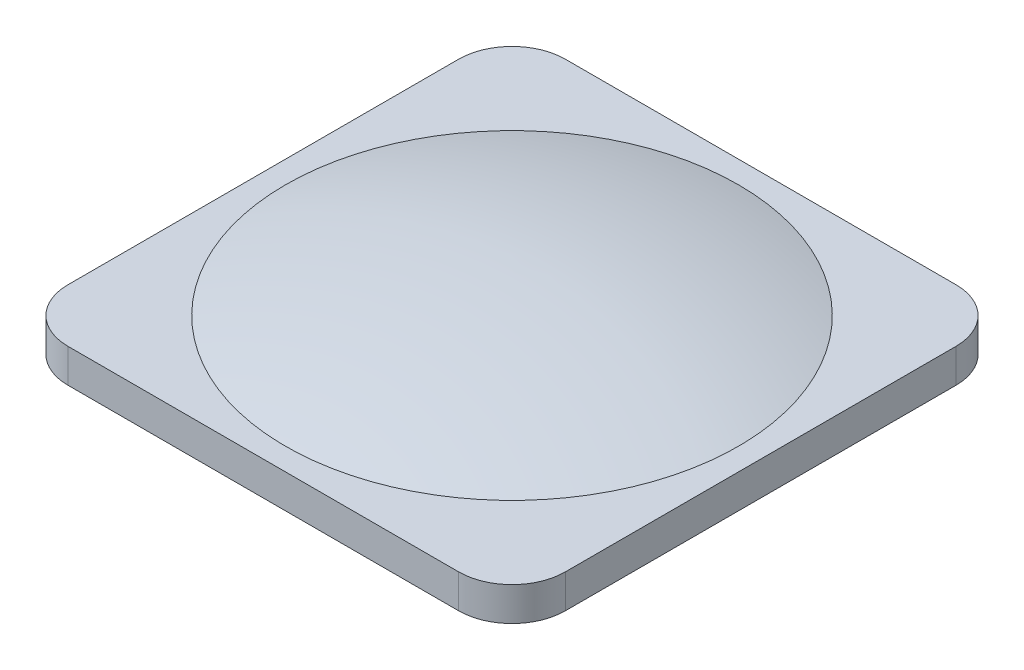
SolidWorks part; units mm, degrees
ref_plane "Vorne" through (0, 0, 0) normal (0, 0, 1) x (1, 0, 0)
ref_plane "Oben" through (0, 0, 0) normal (0, 1, 0) x (1, 0, 0)
ref_plane "Rechts" through (0, 0, 0) normal (1, 0, 0) x (0, 0, -1)
sketch "Skizze1" plane through (0, 0, 0) normal (0, 1, 0) x (1, 0, 0)
  line L1 (0, 0) -> (140, 0)
  line L2 (0, 0) -> (0, 140)
  line L3 (0, 140) -> (140, 140)
  line L4 (140, 0) -> (140, 140)
  dimension "D1" = 140
  dimension "D2" = 140
extrude "Linear austragen1" add sketch "Skizze1" along normal blind 9.5
ref_plane "Ebene1" through (0, 0, -70) normal (0, 0, 1) x (1, 0, 0)
sketch "Skizze3" plane through (0, 0, -70) normal (0, 0, 1) x (1, 0, 0)
  line L0 (70, 9.5) -> (70, 19.5)
  line L1 (140, 9.5) -> (0, 9.5) construction
  line L4 (70, 9.5) -> (70, 58.1805) construction
  line L5 (70, 9.5) -> (6.25, 9.5)
  line L6 (6.25, 9.5) -> (70, 9.5)
  arc A0 (6.25, 9.5) -> (70, 19.5) centre (70, -188.7031) cw
  dimension "D3" = 208.2031
  dimension "D1" = 10
  dimension "D2" = 63.75
fillet "Verrundung1" radius 15 4 edges at (0, 4.75, -140) (140, 4.75, -140) (140, 4.75, 0) (0, 4.75, 0)
revolve "Rotation2" add sketch "Skizze3" angle 360 about L4
shell "Wandung3" thickness 1.5
